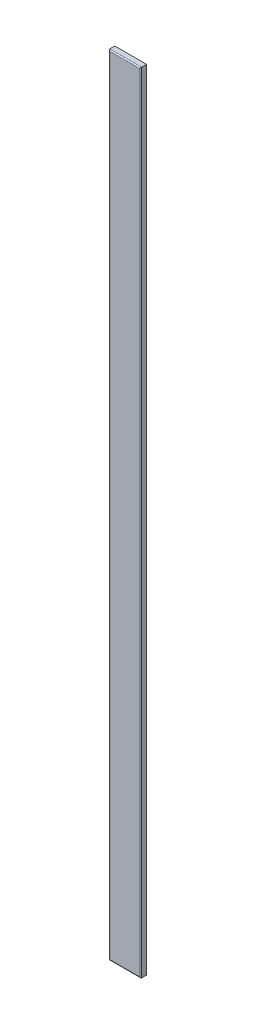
SolidWorks part; units mm, degrees
ref_plane "Спереди" through (0, 0, 0) normal (0, 0, 1) x (1, 0, 0)
ref_plane "Сверху" through (0, 0, 0) normal (0, 1, 0) x (1, 0, 0)
ref_plane "Справа" through (0, 0, 0) normal (1, 0, 0) x (0, 0, -1)
sketch "Эскиз1" plane through (0, 0, 0) normal (0, 0, 1) x (1, 0, 0)
  line L0 (-525.9, 1089.8) -> (525.9, 1089.8) construction
  line L1 (442.1, 1089.8) -> (527.1, 1089.8)
  line L2 (442.1, 1089.8) -> (442.1, -1019.8)
  line L3 (442.1, -1019.8) -> (527.1, -1019.8)
  line L4 (527.1, 1089.8) -> (527.1, -1019.8)
  line L5 (527.1, 1088.6) -> (527.1, -1029.8) construction
  line L7 (467.1, -1029.8) -> (524.9, -1029.8) construction
  line L8 (442.1, 1004.8) -> (442.1, -1004.8) construction
  dimension "D1" = 10
extrude "Бобышка-Вытянуть1" add sketch "Эскиз1" along normal blind 16
fillet "Скругление1" radius 3 4 edges at (484.6, -1019.8, 16) (527.1, 35, 16) (484.6, 1089.8, 16) (442.1, 35, 16)
